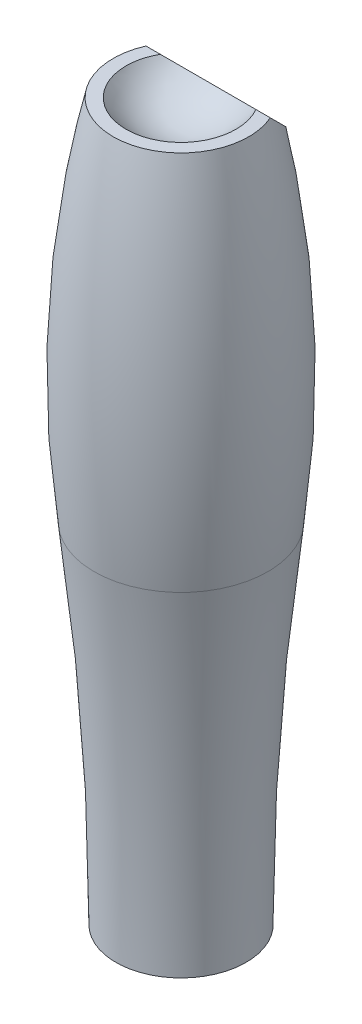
SolidWorks part; units mm, degrees
ref_plane "Přední" through (0, 0, 0) normal (0, 0, 1) x (1, 0, 0)
ref_plane "Horní" through (0, 0, 0) normal (0, 1, 0) x (1, 0, 0)
ref_plane "Pravá" through (0, 0, 0) normal (1, 0, 0) x (0, 0, -1)
sketch "Skica1" plane through (0, 0, 0) normal (0, 0, 1) x (1, 0, 0)
  line L0 (0, 0) -> (0, 379.5)
  line L1 (0, 379.5) -> (35.9375, 379.5)
  line L2 (34.5, 0) -> (0, 0)
  line L3 (0, 0) -> (0, -16.447) construction
  line L4 (34.5, 0) -> (34.5, -72.7987) construction
  arc A0 (35.9375, 379.5) -> (46.0201, 185) centre (-505.3117, 253.9311) cw
  arc A1 (46.0201, 185) -> (34.5, 0) centre (1525.7067, 0) ccw
  dimension "D4" = 100.625
  dimension "D1" = 71.875
  dimension "D2" = 379.5
  dimension "D3" = 69
  dimension "D5" = 185
revolve "Otočit kolem osy1" add sketch "Skica1" angle 360 about L0
sketch "Skica2" plane through (0, 0, 0) normal (0, 0, 1) x (1, 0, 0)
  line L0 (0, 363.5) -> (0, 398)
  line L1 (0, 398) -> (-34.5, 398)
  line L2 (0, 363.5) -> (58.1664, 363.5) construction
  line L3 (0, 398) -> (0, 288.1436) construction
  line L4 (-34.5, 398) -> (-34.5, 273.6677) construction
  line L5 (35.9375, 379.5) -> (-35.9375, 379.5) construction
  arc A0 (0, 363.5) -> (-34.5, 398) centre (0, 398) cw
  dimension "D1" = 69
  dimension "D2" = 16
revolve "Odebrat otočením1" cut sketch "Skica2" angle 360 about L0
sketch "Skica3" plane through (0, 0, 0) normal (0, 0, 1) x (1, 0, 0)
  line L0 (0, -5) -> (0, 23.75)
  line L1 (-28.75, -5) -> (0, -5)
  line L2 (-28.75, -5) -> (-28.75, -18.4225) construction
  line L3 (0, -5) -> (0, -28.9182) construction
  line L4 (-34.5, 0) -> (34.5, 0) construction
  arc A0 (0, 23.75) -> (-28.75, -5) centre (0, -5) ccw
  dimension "D1" = 57.5
  dimension "D2" = 5
revolve "Odebrat otočením2" cut sketch "Skica3" angle 360 about L0
sketch "Skica4" plane through (0, 0, 0) normal (1, 0, 0) x (0, 0, -1)
  line L0 (14.38, 379.5) -> (41.5257, 352.3543)
  line L1 (35.9375, 379.5) -> (-35.9375, 379.5) construction
  arc A0 (46.0201, 185) -> (35.9375, 379.5) centre (-505.3117, 253.9311) ccw construction
  dimension "D1" = 14.38
  dimension "D2" = 45
sketch "Skica5" plane through (0, 379.5, 0) normal (0, 1, 0) x (-1, 0, 0)
  line L0 (0, -14.38) -> (53.7192, -14.38)
ref_plane "Rovina1" through (0, 196.94, -196.94) normal (0, 0.7071, -0.7071) x (-1, 0, 0)
other "Odebrat povrchem1"
